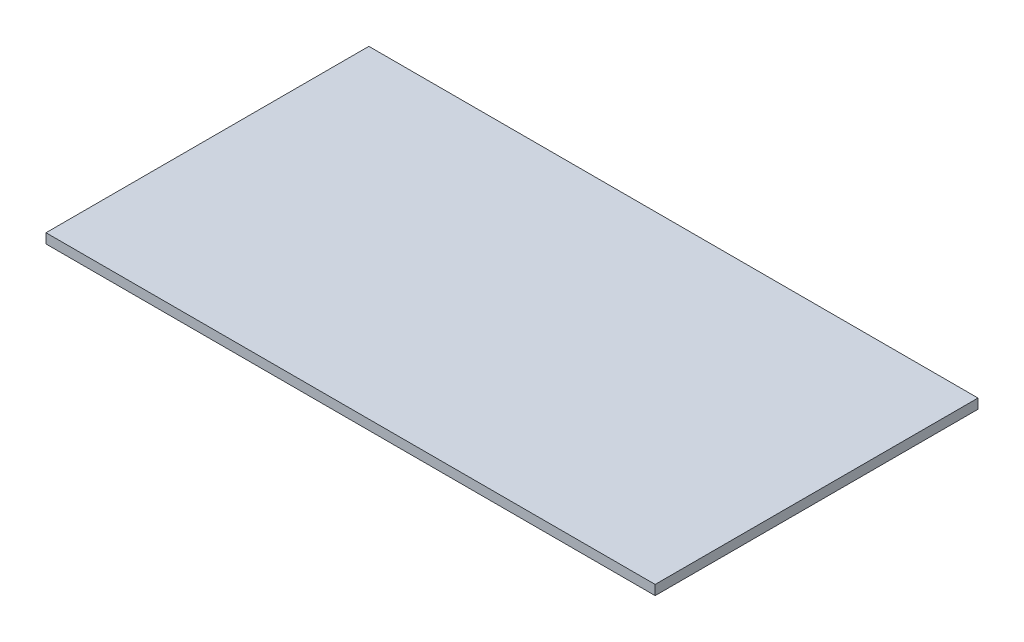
SolidWorks part; units mm, degrees
ref_plane "Front Plane" through (0, 0, 0) normal (0, 0, 1) x (1, 0, 0)
ref_plane "Top Plane" through (0, 0, 0) normal (0, 1, 0) x (1, 0, 0)
ref_plane "Right Plane" through (0, 0, 0) normal (1, 0, 0) x (0, 0, -1)
sketch "Sketch1" plane through (0, 0, 0) normal (0, 1, 0) x (1, 0, 0)
  line L1 (-500, -265) -> (500, -265)
  line L2 (-500, -265) -> (-500, 265)
  line L3 (-500, 265) -> (500, 265)
  line L4 (500, -265) -> (500, 265)
  line L5 (-500, -265) -> (500, 265) construction
  line L6 (-500, 265) -> (500, -265) construction
  point P0 (0, 0)
  dimension "D1" = 1000
  dimension "D2" = 530
extrude "Boss-Extrude1" add sketch "Sketch1" along normal blind 16
